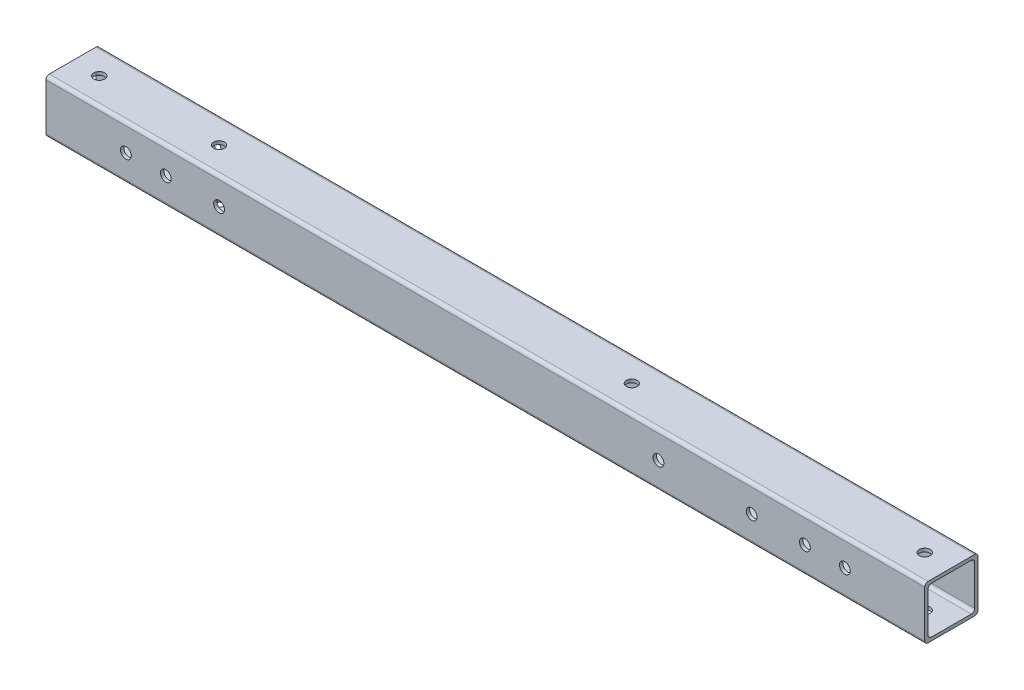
SolidWorks part; units mm, degrees
ref_plane "Front Plane" through (0, 0, 0) normal (0, 0, 1) x (1, 0, 0)
ref_plane "Top Plane" through (0, 0, 0) normal (0, 1, 0) x (1, 0, 0)
ref_plane "Right Plane" through (0, 0, 0) normal (1, 0, 0) x (0, 0, -1)
sketch "Sketch1" plane through (0, 0, 0) normal (0, 1, 0) x (1, 0, 0)
  line L1 (0, 0) -> (-1676.4, 0)
  line L2 (0, 0) -> (0, -101.6)
  line L3 (0, -101.6) -> (-1676.4, -101.6)
  line L4 (-1676.4, 0) -> (-1676.4, -101.6)
  dimension "D1" = 1676.4
  dimension "D2" = 101.6
extrude "Extrude1" add sketch "Sketch1" along normal blind 101.6
sketch "Sketch2" plane through (-1676.4, 0, 0) normal (-1, 0, 0) x (0, 0, 1)
  line L0 (0, 101.6) -> (101.6, 101.6) construction
  line L1 (6.35, 95.25) -> (95.25, 95.25)
  line L2 (6.35, 95.25) -> (6.35, 6.35)
  line L3 (6.35, 6.35) -> (95.25, 6.35)
  line L4 (95.25, 95.25) -> (95.25, 6.35)
  line L5 (0, 0) -> (101.6, 0) construction
  line L6 (101.6, 101.6) -> (101.6, 0) construction
  line L7 (0, 101.6) -> (0, 0) construction
  dimension "D1" = 6.35
  dimension "D2" = 6.35
  dimension "D3" = 6.35
  dimension "D4" = 6.35
extrude "Cut-Extrude1" cut sketch "Sketch2" against normal up to next
sketch "Sketch3" plane through (0, 101.6, 0) normal (0, 1, 0) x (1, 0, 0)
  line L0 (0, -101.6) -> (0, 0) construction
  line L1 (-1676.4, -101.6) -> (0, -101.6) construction
  circle A0 centre (-1625.6, -50.8) radius 10.3188
  dimension "D1" = 20.6375
  dimension "D2" = 1625.6
  dimension "D3" = 50.8
extrude "Cut-Extrude2" cut sketch "Sketch3" against normal through all
fillet "Fillet1" radius 6.35 8 edges at (-838.2, 6.35, 95.25) (-838.2, 0, 101.6) (-838.2, 101.6, 101.6) (-838.2, 95.25, 95.25) (-838.2, 95.25, 6.35) (-838.2, 101.6, 0) (-838.2, 6.35, 6.35) (-838.2, 0, 0)
sketch "Sketch4" plane through (0, 0, 0) normal (0, 0, 1) x (1, 0, 0)
  circle A0 centre (-1524, 50.8) radius 10.3188
  dimension "D1" = 20.6375
  dimension "D2" = 1524
  dimension "D3" = 50.8
extrude "Cut-Extrude3" cut sketch "Sketch4" along normal blind 101.6
sketch "Sketch5" plane through (0, 0, 0) normal (0, 0, -1) x (-1, 0, 0)
  line L0 (0, 95.25) -> (0, 6.35) construction
  line L1 (0, 6.35) -> (1676.4, 6.35) construction
  circle A0 centre (1447.8, 50.8) radius 10.3188
  circle A1 centre (1346.2, 50.8) radius 10.3188
  dimension "D1" = 20.6375
  dimension "D2" = 1346.2
  dimension "D3" = 1447.8
  dimension "D4" = 44.45
extrude "Cut-Extrude4" cut sketch "Sketch5" against normal blind 101.6
ref_plane "Plane1" through (-838.2, 0, 0) normal (1, 0, 0) x (0, 0, -1)
mirror "Mirror1" about plane through (-838.2, 0, 0) normal (1, 0, 0) of "Cut-Extrude4", "Cut-Extrude3", "Cut-Extrude2"
sketch "Sketch6" plane through (0, 101.6, 0) normal (0, 1, 0) x (1, 0, 0)
  line L0 (-1676.4, -6.35) -> (-1676.4, -95.25) construction
  line L1 (0, -6.35) -> (-1676.4, -6.35) construction
  circle A0 centre (-609.6, -50.8) radius 10.3188
  dimension "D1" = 20.6375
  dimension "D2" = 1066.8
  dimension "D3" = 44.45
extrude "Cut-Extrude5" cut sketch "Sketch6" against normal blind 101.6
sketch "Sketch7" plane through (0, 0, 0) normal (0, 0, -1) x (-1, 0, 0)
  line L0 (1676.4, 95.25) -> (1676.4, 6.35) construction
  line L1 (1676.4, 95.25) -> (0, 95.25) construction
  circle A0 centre (508, 50.8) radius 10.3188
  dimension "D1" = 20.6375
  dimension "D2" = 1168.4
  dimension "D3" = 44.45
extrude "Cut-Extrude6" cut sketch "Sketch7" against normal blind 101.6
sketch "Sketch8" plane through (0, 101.6, 0) normal (0, 1, 0) x (1, 0, 0)
  line L0 (0, -95.25) -> (0, -6.35) construction
  line L1 (0, -6.35) -> (-1676.4, -6.35) construction
  circle A0 centre (-1397, -50.8) radius 10.3188
  dimension "D1" = 20.6375
  dimension "D2" = 1397
  dimension "D3" = 44.45
extrude "Cut-Extrude7" cut sketch "Sketch8" against normal blind 101.6
